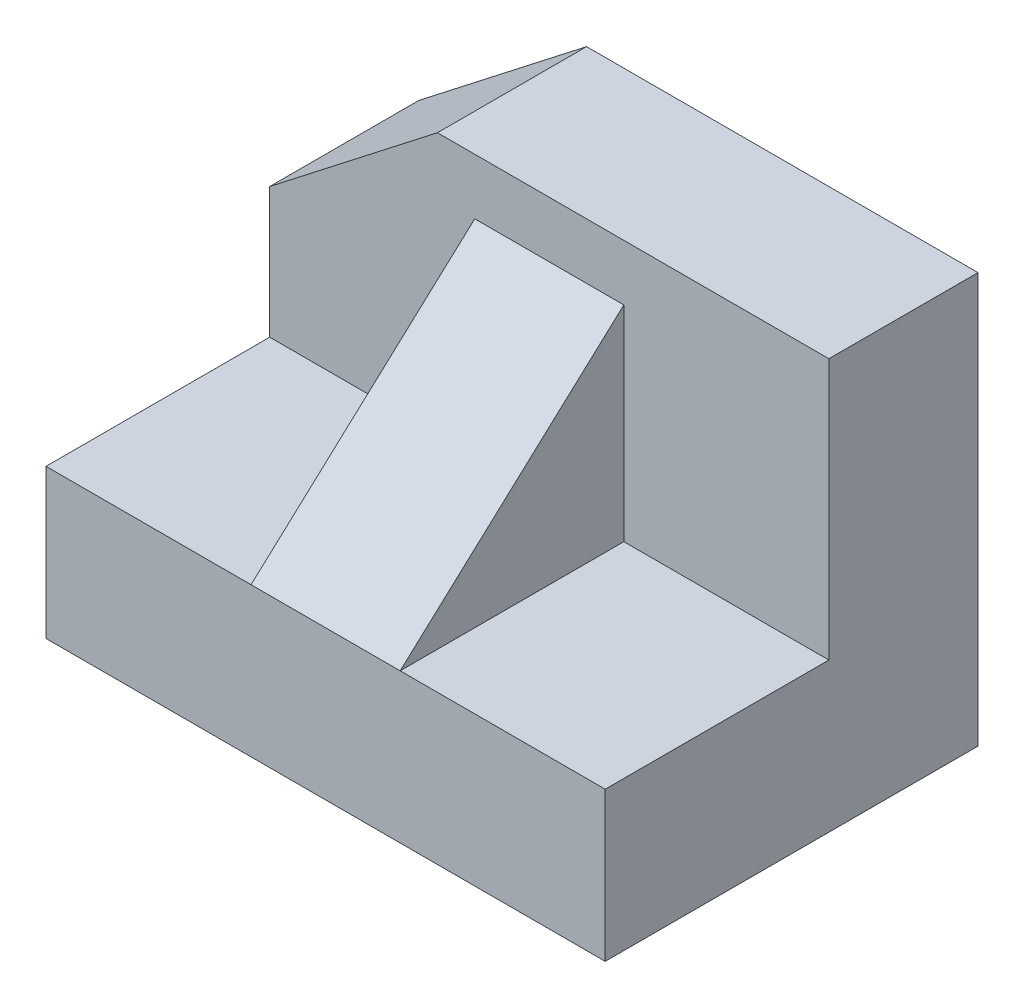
SolidWorks part; units mm, degrees
ref_plane "前视基准面" through (0, 0, 0) normal (0, 0, 1) x (1, 0, 0)
ref_plane "上视基准面" through (0, 0, 0) normal (0, 1, 0) x (1, 0, 0)
ref_plane "右视基准面" through (0, 0, 0) normal (1, 0, 0) x (0, 0, -1)
sketch "草图1" plane through (0, 0, 0) normal (0, 1, 0) x (1, 0, 0)
  line L1 (0, 0) -> (30, 0)
  line L2 (0, 0) -> (0, 20)
  line L3 (0, 20) -> (30, 20)
  line L4 (30, 0) -> (30, 20)
  dimension "D1" = 30
  dimension "D2" = 20
extrude "拉伸1" add sketch "草图1" along normal blind 8
sketch "草图2" plane through (0, 8, 0) normal (0, 1, 0) x (1, 0, 0)
  line L0 (30, 0) -> (30, 20) construction
  line L1 (0, 20) -> (30, 20)
  line L2 (0, 20) -> (0, 12)
  line L3 (0, 12) -> (30, 12)
  line L4 (30, 20) -> (30, 12)
  dimension "D1" = 8
extrude "拉伸2" add sketch "草图2" along normal blind 14
ref_plane "基准面1" through (11, 0, 0) normal (1, 0, 0) x (0, 0, -1)
sketch "草图3" plane through (11, 0, 0) normal (1, 0, 0) x (0, 0, -1)
  line L0 (12, 19) -> (0, 8)
  line L2 (0, 8) -> (12, 8)
  line L3 (12, 8) -> (12, 19)
  dimension "D1" = 11
extrude "拉伸3" add sketch "草图3" along normal blind 8
sketch "草图4" plane through (0, 0, -12) normal (0, 0, 1) x (1, 0, 0)
  line L0 (9, 22) -> (0, 15)
  line L1 (0, 22) -> (30, 22) construction
  line L3 (0, 22) -> (0, 8) construction
  dimension "D1" = 21
  dimension "D2" = 15
extrude "切除-拉伸1" cut sketch "草图4" against normal through all and the other way through all flip side to cut
